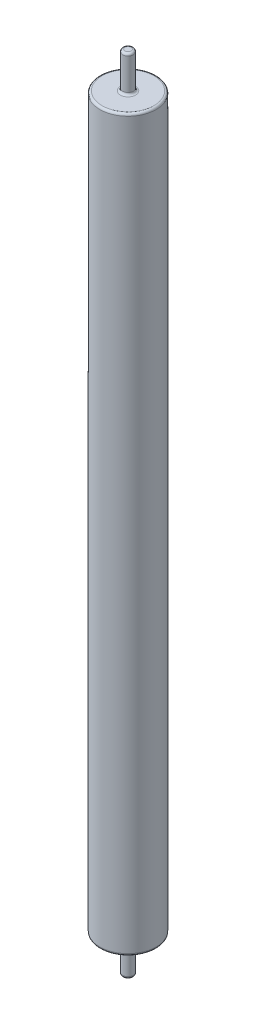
SolidWorks part; units mm, degrees
ref_plane "Front Plane" through (0, 0, 0) normal (0, 0, 1) x (1, 0, 0)
ref_plane "Top Plane" through (0, 0, 0) normal (0, 1, 0) x (1, 0, 0)
ref_plane "Right Plane" through (0, 0, 0) normal (1, 0, 0) x (0, 0, -1)
sketch "Sketch1" plane through (0, 0, 0) normal (0, 1, 0) x (1, 0, 0)
  circle A0 centre (0, 0) radius 25
  dimension "D1" = 50
extrude "Boss-Extrude1" add sketch "Sketch1" along normal blind 712
sketch "Sketch2" plane through (0, 712, 0) normal (0, 1, 0) x (1, 0, 0)
  circle A0 centre (0, 0) radius 4.7625
  circle A2 centre (0, 0) radius 25
  dimension "D1" = 9.525
  dimension "D2" = 50
extrude "Cut-Extrude1" cut sketch "Sketch2" against normal blind 32
sketch "Sketch3" plane through (0, 0, 0) normal (0, -1, 0) x (1, 0, 0)
  circle A0 centre (0, 0) radius 4.7625
  circle A1 centre (0, 0) radius 25
  dimension "D1" = 9.525
  dimension "D2" = 50
extrude "Cut-Extrude2" cut sketch "Sketch3" against normal blind 32
fillet "Fillet1" radius 2 6 edges at (0, 32, -4.7625) (0, 32, -25) (0, 712, 4.7625) (0, 680, 25) (0, 680, 4.7625) (0, 0, -4.7625)
sketch "Sketch4" plane through (0, 0, 0) normal (1, 0, 0) x (0, 0, -1)
  circle A0 centre (3.5707, 337.95) radius 1.5
  dimension "D1" = 3
extrude "Cut-Extrude3" cut sketch "Sketch4" against normal blind 30
